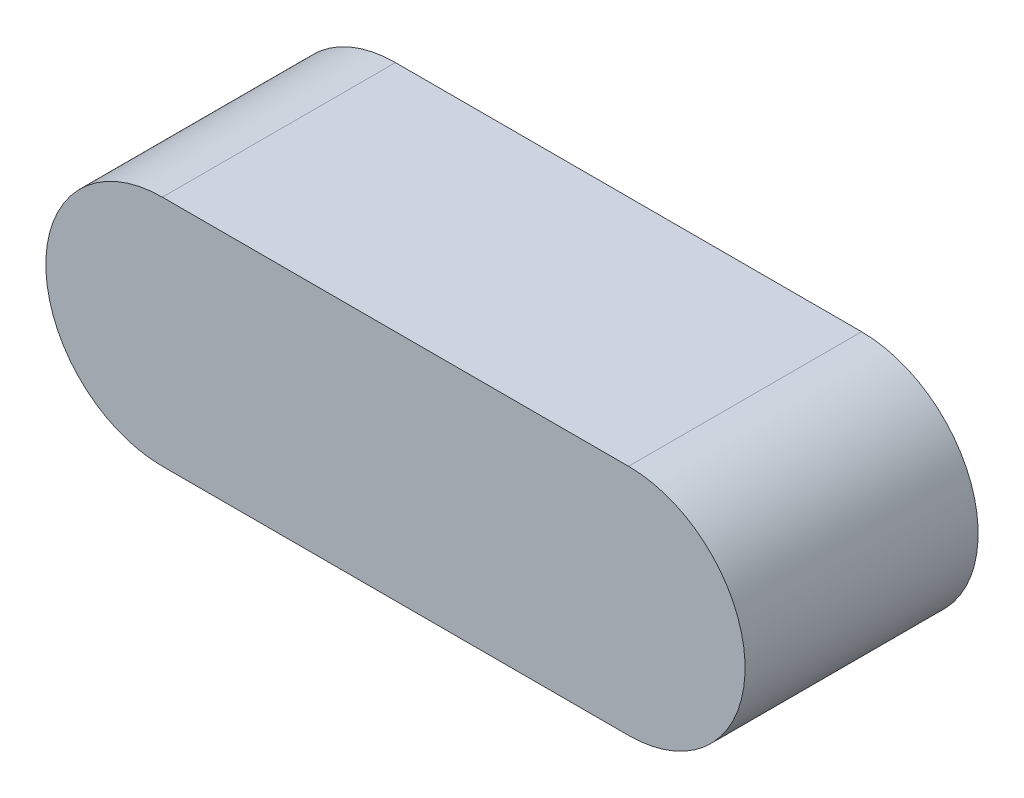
SolidWorks part; units mm, degrees
ref_plane "前视基准面" through (0, 0, 0) normal (0, 0, 1) x (1, 0, 0)
ref_plane "上视基准面" through (0, 0, 0) normal (0, 1, 0) x (1, 0, 0)
ref_plane "右视基准面" through (0, 0, 0) normal (1, 0, 0) x (0, 0, -1)
sketch "草图1" plane through (0, 0, 0) normal (0, 0, 1) x (1, 0, 0)
  line L2 (-71.1107, 2) -> (-63.1107, 2)
  line L3 (-63.1107, -2) -> (-71.1107, -2)
  arc A0 (-71.1107, 2) -> (-71.1107, -2) centre (-71.1107, 0) ccw construction
  arc A2 (-71.1107, 2) -> (-71.1107, -2) centre (-71.1107, 0) ccw
  arc A3 (-63.1107, -2) -> (-63.1107, 2) centre (-63.1107, 0) ccw
  arc A6 (-63.1107, -2) -> (-63.1107, 2) centre (-63.1107, 0) ccw construction
extrude "拉伸1" add sketch "草图1" along normal blind 4
